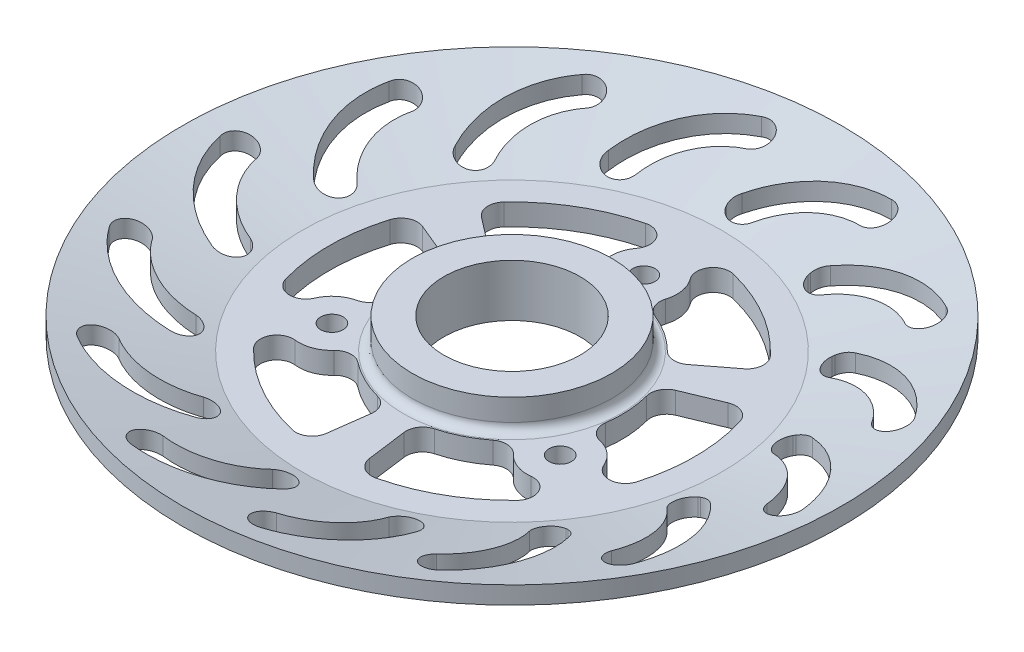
SolidWorks part; units mm, degrees
ref_plane "Front Plane" through (0, 0, 0) normal (0, 0, 1) x (1, 0, 0)
ref_plane "Top Plane" through (0, 0, 0) normal (0, 1, 0) x (1, 0, 0)
ref_plane "Right Plane" through (0, 0, 0) normal (1, 0, 0) x (0, 0, -1)
sketch "Sketch1" plane through (0, 0, 0) normal (0, 1, 0) x (1, 0, 0)
  circle A0 centre (0, 0) radius 95.25
  dimension "D1" = 190.5
extrude "Boss-Extrude1" add sketch "Sketch1" along normal blind 15.0812
sketch "Sketch2" plane through (0, 0, 0) normal (0, 0, 1) x (1, 0, 0)
  line L0 (28.829, 15.0812) -> (28.829, 6.2465)
  line L1 (95.25, 15.0812) -> (-95.25, 15.0812) construction
  line L2 (28.829, 6.2465) -> (60.579, 6.2465)
  line L3 (60.579, 6.2465) -> (95.25, 15.0812)
  line L4 (95.25, 0) -> (95.25, 15.0812) construction
  line L5 (28.829, 15.0812) -> (95.25, 15.0812)
  line L6 (95.25, 10.0012) -> (56.0013, 0)
  line L7 (-95.25, 0) -> (95.25, 0) construction
  line L8 (95.25, 15.0812) -> (95.25, 10.0012)
  line L9 (56.0013, 0) -> (28.829, 0)
  line L10 (28.829, 0) -> (28.829, 6.2465)
  line L11 (56.0013, 0) -> (95.25, 0)
  line L12 (95.25, 0) -> (95.25, 10.0012)
  line L13 (0, 0) -> (0, 77.0229) construction
  dimension "D1" = 8.8348
  dimension "D2" = 28.829
  dimension "D3" = 31.75
  dimension "D4" = 5.08
revolve "Cut-Revolve1" cut sketch "Sketch2" angle 360 about L13
sketch "Sketch3" plane through (0, 15.0812, 0) normal (0, 1, 0) x (1, 0, 0)
  circle A0 centre (0, 0) radius 19.685
  dimension "D1" = 39.37
extrude "Cut-Extrude1" cut sketch "Sketch3" against normal up to next
sketch "Sketch4" plane through (0, 6.2465, 0) normal (0, 1, 0) x (1, 0, 0)
  circle A0 centre (0, 38.1) radius 3.2385
  circle A1 centre (0, 0) radius 28.829 construction
  dimension "D1" = 6.477
  dimension "D2" = 38.1
extrude "Cut-Extrude2" cut sketch "Sketch4" against normal up to next
pattern_circular "CirPattern1" count 3 over 360 about axis through (0, 0, 0) along (0, 1, 0) of "Cut-Extrude2"
sketch "Sketch5" plane through (0, 15.0812, 0) normal (0, 1, 0) x (1, 0, 0)
  line L0 (0, 0) -> (0, 156.7805) construction
  line L1 (-123.494, 0) -> (143.2431, 0) construction
  circle A0 centre (0, 0) radius 95.25 construction
  point P5 (0, 95.25)
sketch "Sketch6" plane through (0, 6.2465, 0) normal (0, 1, 0) x (1, 0, 0)
  circle A0 centre (0, 0) radius 60.579 construction
  point P0 (0, 60.579)
ref_plane "Plane1" through (0, 15.0812, 0) normal (0, 1, 0) x (-1, 0, 0)
sketch "Sketch7" plane through (0, 15.0812, 0) normal (0, 1, 0) x (-1, 0, 0)
  line L0 (0, 67.8263) -> (0, 131.4181) construction
  arc A0 (0, 67.8263) -> (-24.13, 81.1289) centre (-22.36, 55.8031) ccw construction
  arc A1 (-24.0866, 85.5737) -> (-24.1453, 76.6839) centre (-24.13, 81.1289) ccw
  arc A2 (-24.0866, 85.5737) -> (3.7353, 70.2358) centre (-22.36, 55.8031) cw
  arc A3 (-3.7504, 65.4404) -> (3.7353, 70.2358) centre (0, 67.8263) ccw
  arc A4 (-24.1453, 76.6839) -> (-3.7504, 65.4404) centre (-22.36, 55.8031) cw
  arc A6 (0, 67.8263) -> (24.13, 81.1289) centre (22.36, 55.8031) cw construction
  arc A7 (24.1453, 76.6839) -> (3.7504, 65.4404) centre (22.36, 55.8031) ccw
  arc A8 (3.7504, 65.4404) -> (-3.7353, 70.2358) centre (0, 67.8263) cw
  arc A9 (24.0866, 85.5737) -> (-3.7353, 70.2358) centre (22.36, 55.8031) ccw
  arc A10 (24.0866, 85.5737) -> (24.1453, 76.6839) centre (24.13, 81.1289) cw
  point P3 (-10.9557, 77.7519)
  point P19 (10.9557, 77.7519)
  dimension "D2" = 4.445
  dimension "D4" = 24.13
  dimension "D5" = 4.445
  dimension "D6" = 20.957
  dimension "D7" = 29.8206
fillet "Fillet1" radius 2.54 1 edges at (0, 6.2465, -28.829)
sketch "Sketch9" plane through (0, 0, 0) normal (0, -1, 0) x (1, 0, 0)
  line L0 (0, 0) -> (-48.4986, 28.0007) construction
  line L1 (0, 0) -> (-45.749, -26.4132) construction
  line L2 (0, -56.0013) -> (0, 0) construction
  line L3 (0, 0) -> (-41.91, -32.1586)
  line L4 (0, 0) -> (-48.8052, -20.2158)
  circle A0 centre (0, 0) radius 56.0013 construction
  circle A3 centre (0, 0) radius 52.8263
  circle A4 centre (0, 0) radius 52.8263
  circle A6 centre (0, 0) radius 31.75
  circle A7 centre (0, 0) radius 31.75
  circle A9 centre (-32.9956, 19.05) radius 9.5885
  circle A10 centre (-32.9956, 19.05) radius 9.5885
  circle A11 centre (-46.17, 13.3591) radius 4.7625
  circle A12 centre (0, -38.1) radius 9.5885
  circle A13 centre (0, -38.1) radius 9.5885
  circle A14 centre (-36.1612, 5.0525) radius 4.7625
  circle A15 centre (-11.5157, -46.6639) radius 4.7625
  circle A16 centre (-13.705, -33.8428) radius 4.7625
  circle A17 centre (-35.0447, -32.8938) radius 4.7625
  circle A18 centre (-25.8206, -25.8159) radius 4.7625
  circle A19 centre (-46.0092, -13.9027) radius 4.7625
  circle A20 centre (-35.2675, -9.4534) radius 4.7625
  point P5 (-32.9956, 19.05)
  dimension "D5" = 9.525
  dimension "D6" = 15
  dimension "D1" = 3.175
  dimension "D2" = 12.065
  dimension "D3" = 6.35
  dimension "D4" = 6.35
extrude "Cut-Extrude7" cut sketch "Sketch9" against normal through all contours A20 A7 A14 A10 A11 A4 A19 L4 | A18 L3 A17 A4 A15 A13 A16 A7 | A16 | A15 | A18 | A17 | A19 | A20 | A14 | A11
pattern_circular "CirPattern4" count 3 over 360 about axis through (0, 0, 0) along (0, 1, 0) of "Cut-Extrude7"
extrude "Cut-Extrude8" cut sketch "Sketch7" against normal through all contours A10 A9 A2 A3 A7 | A2 A9 A8 A4 A3 A7
pattern_circular "CirPattern5" count 14 over 360 about axis through (0, 0, 0) along (0, 1, 0) of "Cut-Extrude8"
